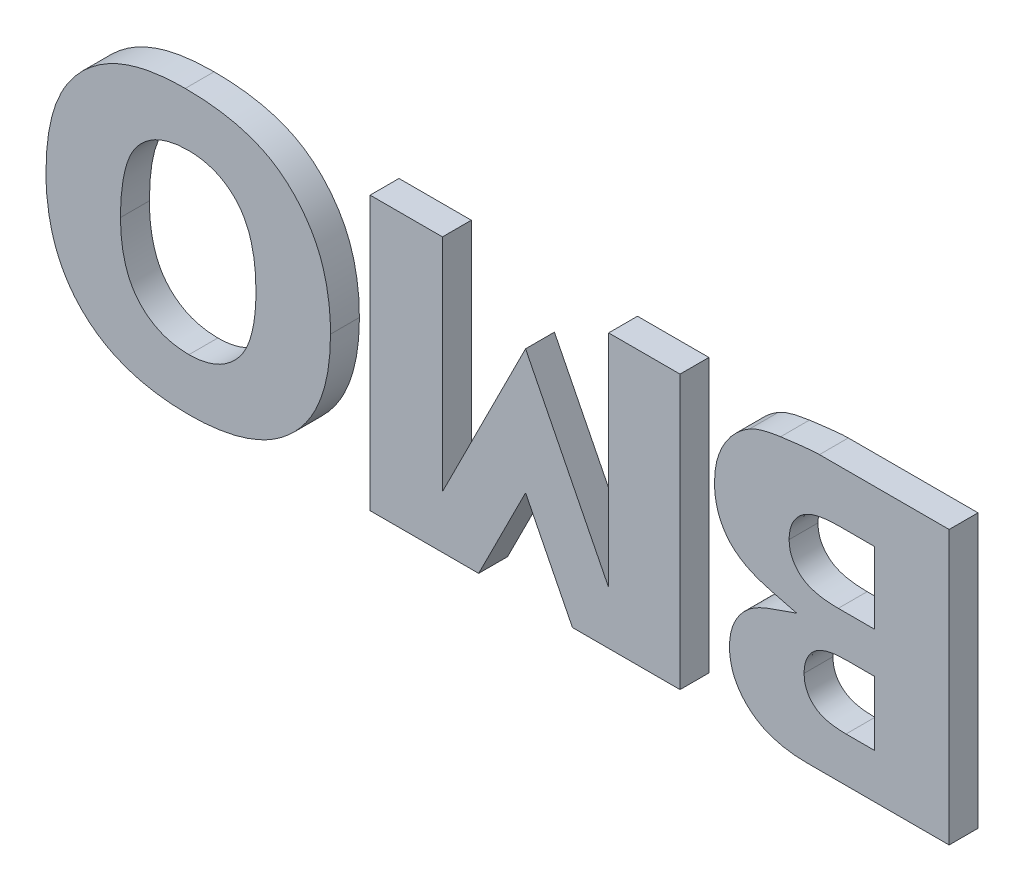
SolidWorks part; units mm, degrees
ref_plane "Front Plane" through (0, 0, 0) normal (0, 0, 1) x (1, 0, 0)
ref_plane "Top Plane" through (0, 0, 0) normal (0, 1, 0) x (1, 0, 0)
ref_plane "Right Plane" through (0, 0, 0) normal (1, 0, 0) x (0, 0, -1)
sketch "Sketch1" plane through (0, 0, 0) normal (0, 0, 1) x (1, 0, 0)
  line L19 (0.0088, 21.4902) -> (2.4024, 21.4902)
  line L20 (2.4024, 21.4902) -> (2.4024, 26.2173)
  line L21 (2.4024, 26.2173) -> (-0.0032, 26.2173)
  line L22 (0.0088, 21.4902) -> (2.4024, 21.4902)
  line L23 (2.4024, 21.4902) -> (2.4024, 26.2173)
  line L24 (2.4024, 26.2173) -> (-0.0032, 26.2173)
  line L25 (-10.4349, 29.6545) -> (-15.1464, 29.6545)
  line L26 (-10.4349, 11.6205) -> (-10.4349, 29.6545)
  line L27 (-17.5344, 11.6205) -> (-10.4349, 11.6205)
  line L28 (-20.6288, 17.7752) -> (-17.5344, 11.6205)
  line L29 (-23.7231, 11.6205) -> (-20.6288, 17.7752)
  line L30 (-30.8869, 11.6205) -> (-23.7231, 11.6205)
  line L31 (-30.8869, 29.6576) -> (-30.8869, 11.6205)
  line L32 (-26.1136, 29.6576) -> (-30.8869, 29.6576)
  line L33 (-26.1107, 15.1008) -> (-26.1136, 29.6576)
  line L34 (-20.6288, 26.0046) -> (-26.1107, 15.1008)
  line L35 (-15.1464, 15.0999) -> (-20.6288, 26.0046)
  line L36 (-15.1464, 29.6545) -> (-15.1464, 15.0999)
  line L37 (-10.4349, 29.6545) -> (-15.1464, 29.6545)
  line L38 (-10.4349, 11.6205) -> (-10.4349, 29.6545)
  line L39 (-17.5344, 11.6205) -> (-10.4349, 11.6205)
  line L40 (-20.6288, 17.7752) -> (-17.5344, 11.6205)
  line L41 (-23.7231, 11.6205) -> (-20.6288, 17.7752)
  line L42 (-30.8869, 11.6205) -> (-23.7231, 11.6205)
  line L43 (-30.8869, 29.6576) -> (-30.8869, 11.6205)
  line L44 (-26.1136, 29.6576) -> (-30.8869, 29.6576)
  line L45 (-26.1107, 15.1008) -> (-26.1136, 29.6576)
  line L46 (-20.6288, 26.0046) -> (-26.1107, 15.1008)
  line L47 (-15.1464, 15.0999) -> (-20.6288, 26.0046)
  line L48 (-15.1464, 29.6545) -> (-15.1464, 15.0999)
  line L52 (0.5196, 14.5629) -> (2.4024, 14.5629)
  line L53 (2.4024, 14.5629) -> (2.4024, 18.7952)
  line L54 (2.4024, 18.7952) -> (0.5565, 18.7952)
  line L55 (0.5196, 14.5629) -> (2.4024, 14.5629)
  line L56 (2.4024, 14.5629) -> (2.4024, 18.7952)
  line L57 (2.4024, 18.7952) -> (0.5565, 18.7952)
  line L62 (7.3241, 29.6545) -> (-1.2328, 29.6545)
  line L63 (7.3241, 11.6205) -> (7.3241, 29.6545)
  line L64 (-2.0181, 11.6205) -> (7.3241, 11.6205)
  line L65 (7.3241, 29.6545) -> (-1.2328, 29.6545)
  line L66 (7.3241, 11.6205) -> (7.3241, 29.6545)
  line L67 (-2.0181, 11.6205) -> (7.3241, 11.6205)
  spline S8 degree 3 poles (2946.2117, 319.9501) (-99.8182, -23.9874) (-36.9608, 2.5634) (-38.4871, 21.7907) (-38.5315, 22.1346) (-38.6293, 22.6467) (-38.6672, 22.8168) (-38.755, 23.1555) (-38.8052, 23.3239) (-38.9238, 23.6512) (-38.9925, 23.8107) (-39.145, 24.123) (-39.2289, 24.276) (-39.5162, 24.7183) (-39.7459, 24.9766) (-40.1351, 25.3211) (-40.2741, 25.4289) (-40.5653, 25.6223) (-40.7162, 25.7081) (-41.1836, 25.9357) (-41.5196, 26.0465) (-42.0303, 26.1518) (-42.2018, 26.1778) (-53.6648, 27.215) (-71.7276, -20.3538) (338.05, 3001.641) knots -6.698204 -6.698204 -6.698204 -6.698204 0.125 0.125 0.25 0.25 0.3125 0.3125 0.375 0.375 0.4375 0.4375 0.5 0.5 0.625 0.625 0.6875 0.6875 0.75 0.75 0.875 0.875 0.9375 0.9375 5.018063 5.018063 5.018063 5.018063 only from (-38.4226, 20.4017) to (-42.8967, 26.2174)
  spline S9 degree 3 poles (-568.1807, 2979.6168) (-11.22, -20.6149) (-31.9587, 27.2298) (-43.6103, 26.1769) (-43.7856, 26.1505) (-44.1331, 26.0814) (-44.3052, 26.0379) (-44.6448, 25.9272) (-44.814, 25.8594) (-45.3004, 25.6226) (-45.5957, 25.4204) (-46.1306, 24.9303) (-46.3603, 24.6553) (-46.632, 24.1881) (-46.7112, 24.0235) (-46.8504, 23.6914) (-46.9107, 23.5226) (-47.0709, 23.0095) (-47.1473, 22.6575) (-47.2602, 21.9439) (-47.2983, 21.5857) (-48.6988, 0.955) (11.489, -23.873) (-3042.5928, 181.7884) knots -3.982714 -3.982714 -3.982714 -3.982714 0.0625 0.0625 0.125 0.125 0.1875 0.1875 0.25 0.25 0.375 0.375 0.5 0.5 0.5625 0.5625 0.625 0.625 0.75 0.75 0.875 0.875 7.929813 7.929813 7.929813 7.929813 only from (-42.8967, 26.2174) to (-47.3555, 20.146)
  spline S10 degree 3 poles (-3012.2401, -435.0201) (16.0763, 66.7315) (-48.9102, 37.2156) (-47.2859, 18.8005) (-47.24, 18.4691) (-47.099, 17.8146) (-47.0072, 17.491) (-46.8197, 17.0142) (-46.7482, 16.8567) (-46.5883, 16.5556) (-46.4996, 16.4107) (-46.2052, 15.9939) (-45.9677, 15.7391) (-45.5763, 15.4116) (-45.4395, 15.3106) (-45.1516, 15.1271) (-44.9988, 15.0449) (-44.6872, 14.9018) (-44.5286, 14.8382) (-44.2044, 14.732) (-44.038, 14.6916) (-43.6996, 14.6268) (-43.5289, 14.6014) (-32.0948, 13.583) (-16.6311, 60.7758) (-270.0105, -2976.5611) knots -6.635897 -6.635897 -6.635897 -6.635897 0.125 0.125 0.25 0.25 0.375 0.375 0.4375 0.4375 0.5 0.5 0.625 0.625 0.6875 0.6875 0.75 0.75 0.8125 0.8125 0.875 0.875 0.9375 0.9375 5.049632 5.049632 5.049632 5.049632 only from (-47.3555, 20.146) to (-42.8422, 14.5628)
  spline S11 degree 3 poles (377.4254, -2955.6335) (-71.9445, 62.3905) (-53.3223, 13.5136) (-42.1506, 14.6053) (-41.9803, 14.6327) (-41.6424, 14.7056) (-41.474, 14.7521) (-41.1452, 14.8689) (-40.9863, 14.9376) (-40.6789, 15.0945) (-40.5303, 15.1827) (-40.2443, 15.3795) (-40.1066, 15.4892) (-39.7208, 15.8381) (-39.4951, 16.0996) (-39.1176, 16.6903) (-38.9718, 17.0049) (-38.739, 17.6604) (-38.6548, 18.0002) (-38.5292, 18.679) (-38.4854, 19.0208) (-36.9919, 38.2441) (-99.0006, 64.9771) (2944.805, -292.5563) knots -3.935499 -3.935499 -3.935499 -3.935499 0.0625 0.0625 0.125 0.125 0.1875 0.1875 0.25 0.25 0.3125 0.3125 0.375 0.375 0.5 0.5 0.625 0.625 0.75 0.75 0.875 0.875 7.737853 7.737853 7.737853 7.737853 only from (-42.8422, 14.5628) to (-38.4226, 20.4017)
  spline S12 degree 3 poles (-38.4226, 20.4017) (-38.4263, 20.7504) (-38.4322, 21.0989) (-38.4871, 21.7907) (-38.5315, 22.1346) (-38.6293, 22.6467) (-38.6672, 22.8168) (-38.755, 23.1555) (-38.8052, 23.3239) (-38.9238, 23.6512) (-38.9925, 23.8107) (-39.145, 24.123) (-39.2289, 24.276) (-39.5162, 24.7183) (-39.7459, 24.9766) (-40.1351, 25.3211) (-40.2741, 25.4289) (-40.5653, 25.6223) (-40.7162, 25.7081) (-41.1836, 25.9357) (-41.5196, 26.0465) (-42.0303, 26.1518) (-42.2018, 26.1778) (-42.5476, 26.2091) (-42.7221, 26.2133) (-42.8967, 26.2174) knots 0 0 0 0 0.125 0.125 0.25 0.25 0.3125 0.3125 0.375 0.375 0.4375 0.4375 0.5 0.5 0.625 0.625 0.6875 0.6875 0.75 0.75 0.875 0.875 0.9375 0.9375 1 1 1 1
  spline S13 degree 3 poles (-42.8967, 26.2174) (-43.0762, 26.2133) (-43.2557, 26.2089) (-43.6103, 26.1769) (-43.7856, 26.1505) (-44.1331, 26.0814) (-44.3052, 26.0379) (-44.6448, 25.9272) (-44.814, 25.8594) (-45.3004, 25.6226) (-45.5957, 25.4204) (-46.1306, 24.9303) (-46.3603, 24.6553) (-46.632, 24.1881) (-46.7112, 24.0235) (-46.8504, 23.6914) (-46.9107, 23.5226) (-47.0709, 23.0095) (-47.1473, 22.6575) (-47.2602, 21.9439) (-47.2983, 21.5857) (-47.347, 20.8673) (-47.3521, 20.5067) (-47.3555, 20.146) knots 0 0 0 0 0.0625 0.0625 0.125 0.125 0.1875 0.1875 0.25 0.25 0.375 0.375 0.5 0.5 0.5625 0.5625 0.625 0.625 0.75 0.75 0.875 0.875 1 1 1 1
  spline S14 degree 3 poles (-47.3555, 20.146) (-47.3516, 19.8073) (-47.3448, 19.4691) (-47.2859, 18.8005) (-47.24, 18.4691) (-47.099, 17.8146) (-47.0072, 17.491) (-46.8197, 17.0142) (-46.7482, 16.8567) (-46.5883, 16.5556) (-46.4996, 16.4107) (-46.2052, 15.9939) (-45.9677, 15.7391) (-45.5763, 15.4116) (-45.4395, 15.3106) (-45.1516, 15.1271) (-44.9988, 15.0449) (-44.6872, 14.9018) (-44.5286, 14.8382) (-44.2044, 14.732) (-44.038, 14.6916) (-43.6996, 14.6268) (-43.5289, 14.6014) (-43.1866, 14.5709) (-43.0144, 14.5668) (-42.8422, 14.5628) knots 0 0 0 0 0.125 0.125 0.25 0.25 0.375 0.375 0.4375 0.4375 0.5 0.5 0.625 0.625 0.6875 0.6875 0.75 0.75 0.8125 0.8125 0.875 0.875 0.9375 0.9375 1 1 1 1
  spline S15 degree 3 poles (-42.8422, 14.5628) (-42.6684, 14.5671) (-42.4945, 14.5717) (-42.1506, 14.6053) (-41.9803, 14.6327) (-41.6424, 14.7056) (-41.474, 14.7521) (-41.1452, 14.8689) (-40.9863, 14.9376) (-40.6789, 15.0945) (-40.5303, 15.1827) (-40.2443, 15.3795) (-40.1066, 15.4892) (-39.7208, 15.8381) (-39.4951, 16.0996) (-39.1176, 16.6903) (-38.9718, 17.0049) (-38.739, 17.6604) (-38.6548, 18.0002) (-38.5292, 18.679) (-38.4854, 19.0208) (-38.432, 19.7085) (-38.4263, 20.055) (-38.4226, 20.4017) knots 0 0 0 0 0.0625 0.0625 0.125 0.125 0.1875 0.1875 0.25 0.25 0.3125 0.3125 0.375 0.375 0.5 0.5 0.625 0.625 0.75 0.75 0.875 0.875 1 1 1 1
  spline S21 degree 3 poles (-426.6471, 3004.6541) (2.7345, -19.2274) (-24.4427, 30.7605) (-44.3381, 29.6086) (-44.6476, 29.5789) (-45.571, 29.4547) (-46.1804, 29.33) (-47.0783, 29.034) (-47.3725, 28.9191) (-47.9411, 28.6586) (-48.2169, 28.5127) (-48.7494, 28.1856) (-49.0061, 28.0027) (-49.5023, 27.6122) (-49.7345, 27.4027) (-50.1668, 26.9549) (-50.369, 26.7185) (-50.7444, 26.2197) (-50.9178, 25.9548) (-51.2328, 25.4109) (-51.3694, 25.1302) (-51.6125, 24.5562) (-51.7174, 24.2622) (-51.8941, 23.6602) (-51.9681, 23.3531) (-52.0887, 22.7385) (-52.1364, 22.4298) (-52.2108, 21.8101) (-52.2361, 21.4989) (-53.2951, 0.0038) (-7.4612, -26.4482) (-3039.4029, 293.0575) knots -3.869763 -3.869763 -3.869763 -3.869763 0.0625 0.0625 0.125 0.125 0.25 0.25 0.3125 0.3125 0.375 0.375 0.4375 0.4375 0.5 0.5 0.5625 0.5625 0.625 0.625 0.6875 0.6875 0.75 0.75 0.8125 0.8125 0.875 0.875 0.9375 0.9375 5.176446 5.176446 5.176446 5.176446 only from (-43.0891, 29.6545) to (-52.2771, 20.2473)
  spline S22 degree 3 poles (2936.5727, 439.8761) (-85.2498, -24.9192) (-32.3655, 2.5437) (-33.5481, 21.6686) (-33.5803, 21.9814) (-33.7114, 22.9143) (-33.846, 23.5287) (-34.1477, 24.4343) (-34.2653, 24.733) (-34.5358, 25.3053) (-34.6899, 25.5806) (-35.0241, 26.1161) (-35.2055, 26.3755) (-35.6041, 26.8737) (-35.8189, 27.1098) (-36.2688, 27.5534) (-36.5054, 27.7615) (-37.0069, 28.1444) (-37.2733, 28.318) (-38.1116, 28.7896) (-38.7013, 29.021) (-39.6192, 29.2787) (-39.9312, 29.3513) (-40.557, 29.4701) (-40.8712, 29.5166) (-41.5014, 29.5903) (-41.8177, 29.6162) (-62.9339, 30.6387) (-88.6306, -17.5161) (193.0725, 3019.9176) knots -3.671464 -3.671464 -3.671464 -3.671464 0.0625 0.0625 0.125 0.125 0.25 0.25 0.3125 0.3125 0.375 0.375 0.4375 0.4375 0.5 0.5 0.5625 0.5625 0.625 0.625 0.75 0.75 0.8125 0.8125 0.875 0.875 0.9375 0.9375 5.034664 5.034664 5.034664 5.034664 only from (-33.501, 20.4043) to (-43.0891, 29.6545)
  spline S23 degree 3 poles (351.3547, -2962.4639) (-89.1716, 57.6277) (-61.8367, 10.0625) (-41.6118, 11.1701) (-41.3033, 11.2009) (-40.3831, 11.3282) (-39.7758, 11.4537) (-38.8797, 11.7392) (-38.5844, 11.8504) (-38.0129, 12.1012) (-37.7346, 12.2405) (-37.1969, 12.5539) (-36.9381, 12.7292) (-36.4383, 13.1129) (-36.2, 13.3182) (-35.5317, 13.9716) (-35.1447, 14.4618) (-34.4883, 15.539) (-34.2348, 16.1089) (-33.9416, 17.0002) (-33.858, 17.3047) (-33.7195, 17.9167) (-33.6644, 18.2244) (-33.5796, 18.8428) (-33.5502, 19.1535) (-32.3597, 40.2905) (-78.0533, 66.5999) (2952.1693, -267.041) knots -3.944482 -3.944482 -3.944482 -3.944482 0.0625 0.0625 0.125 0.125 0.25 0.25 0.3125 0.3125 0.375 0.375 0.4375 0.4375 0.5 0.5 0.625 0.625 0.75 0.75 0.8125 0.8125 0.875 0.875 0.9375 0.9375 5.108022 5.108022 5.108022 5.108022 only from (-42.8579, 11.1258) to (-33.501, 20.4043)
  spline S24 degree 3 poles (-3023.8709, -388.5426) (-4.8731, 66.0069) (-53.367, 38.7648) (-52.231, 19.0054) (-52.1988, 18.6982) (-52.0666, 17.7822) (-51.9368, 17.178) (-51.6395, 16.288) (-51.5238, 15.9955) (-51.2618, 15.4316) (-51.1147, 15.1586) (-50.7877, 14.6307) (-50.6078, 14.3754) (-50.2112, 13.8875) (-49.9986, 13.6598) (-49.5497, 13.2317) (-49.3129, 13.0317) (-48.8124, 12.6626) (-48.5473, 12.4921) (-47.7283, 12.0321) (-47.1528, 11.7963) (-46.2552, 11.5253) (-45.9497, 11.4494) (-45.3384, 11.325) (-45.0312, 11.2753) (-44.4145, 11.1963) (-44.1048, 11.1682) (-22.9971, 10.0928) (3.2848, 55.8069) (-331.1674, -2974.4917) knots -3.865551 -3.865551 -3.865551 -3.865551 0.0625 0.0625 0.125 0.125 0.25 0.25 0.3125 0.3125 0.375 0.375 0.4375 0.4375 0.5 0.5 0.5625 0.5625 0.625 0.625 0.75 0.75 0.8125 0.8125 0.875 0.875 0.9375 0.9375 5.115347 5.115347 5.115347 5.115347 only from (-52.2771, 20.2473) to (-42.8579, 11.1258)
  spline S25 degree 3 poles (-43.0891, 29.6545) (-43.4023, 29.6497) (-43.7155, 29.6446) (-44.3381, 29.6086) (-44.6476, 29.5789) (-45.571, 29.4547) (-46.1804, 29.33) (-47.0783, 29.034) (-47.3725, 28.9191) (-47.9411, 28.6586) (-48.2169, 28.5127) (-48.7494, 28.1856) (-49.0061, 28.0027) (-49.5023, 27.6122) (-49.7345, 27.4027) (-50.1668, 26.9549) (-50.369, 26.7185) (-50.7444, 26.2197) (-50.9178, 25.9548) (-51.2328, 25.4109) (-51.3694, 25.1302) (-51.6125, 24.5562) (-51.7174, 24.2622) (-51.8941, 23.6602) (-51.9681, 23.3531) (-52.0887, 22.7385) (-52.1364, 22.4298) (-52.2108, 21.8101) (-52.2361, 21.4989) (-52.2668, 20.8742) (-52.272, 20.5608) (-52.2771, 20.2473) knots 0 0 0 0 0.0625 0.0625 0.125 0.125 0.25 0.25 0.3125 0.3125 0.375 0.375 0.4375 0.4375 0.5 0.5 0.5625 0.5625 0.625 0.625 0.6875 0.6875 0.75 0.75 0.8125 0.8125 0.875 0.875 0.9375 0.9375 1 1 1 1
  spline S26 degree 3 poles (-33.501, 20.4043) (-33.5048, 20.7217) (-33.5092, 21.0389) (-33.5481, 21.6686) (-33.5803, 21.9814) (-33.7114, 22.9143) (-33.846, 23.5287) (-34.1477, 24.4343) (-34.2653, 24.733) (-34.5358, 25.3053) (-34.6899, 25.5806) (-35.0241, 26.1161) (-35.2055, 26.3755) (-35.6041, 26.8737) (-35.8189, 27.1098) (-36.2688, 27.5534) (-36.5054, 27.7615) (-37.0069, 28.1444) (-37.2733, 28.318) (-38.1116, 28.7896) (-38.7013, 29.021) (-39.6192, 29.2787) (-39.9312, 29.3513) (-40.557, 29.4701) (-40.8712, 29.5166) (-41.5014, 29.5903) (-41.8177, 29.6162) (-42.4522, 29.6469) (-42.7706, 29.6508) (-43.0891, 29.6545) knots 0 0 0 0 0.0625 0.0625 0.125 0.125 0.25 0.25 0.3125 0.3125 0.375 0.375 0.4375 0.4375 0.5 0.5 0.5625 0.5625 0.625 0.625 0.75 0.75 0.8125 0.8125 0.875 0.875 0.9375 0.9375 1 1 1 1
  spline S27 degree 3 poles (-42.8579, 11.1258) (-42.5455, 11.1309) (-42.2331, 11.1361) (-41.6118, 11.1701) (-41.3033, 11.2009) (-40.3831, 11.3282) (-39.7758, 11.4537) (-38.8797, 11.7392) (-38.5844, 11.8504) (-38.0129, 12.1012) (-37.7346, 12.2405) (-37.1969, 12.5539) (-36.9381, 12.7292) (-36.4383, 13.1129) (-36.2, 13.3182) (-35.5317, 13.9716) (-35.1447, 14.4618) (-34.4883, 15.539) (-34.2348, 16.1089) (-33.9416, 17.0002) (-33.858, 17.3047) (-33.7195, 17.9167) (-33.6644, 18.2244) (-33.5796, 18.8428) (-33.5502, 19.1535) (-33.5151, 19.7777) (-33.508, 20.091) (-33.501, 20.4043) knots 0 0 0 0 0.0625 0.0625 0.125 0.125 0.25 0.25 0.3125 0.3125 0.375 0.375 0.4375 0.4375 0.5 0.5 0.625 0.625 0.75 0.75 0.8125 0.8125 0.875 0.875 0.9375 0.9375 1 1 1 1
  spline S28 degree 3 poles (-52.2771, 20.2473) (-52.2718, 19.9358) (-52.2666, 19.6244) (-52.231, 19.0054) (-52.1988, 18.6982) (-52.0666, 17.7822) (-51.9368, 17.178) (-51.6395, 16.288) (-51.5238, 15.9955) (-51.2618, 15.4316) (-51.1147, 15.1586) (-50.7877, 14.6307) (-50.6078, 14.3754) (-50.2112, 13.8875) (-49.9986, 13.6598) (-49.5497, 13.2317) (-49.3129, 13.0317) (-48.8124, 12.6626) (-48.5473, 12.4921) (-47.7283, 12.0321) (-47.1528, 11.7963) (-46.2552, 11.5253) (-45.9497, 11.4494) (-45.3384, 11.325) (-45.0312, 11.2753) (-44.4145, 11.1963) (-44.1048, 11.1682) (-43.4826, 11.1365) (-43.1703, 11.1311) (-42.8579, 11.1258) knots 0 0 0 0 0.0625 0.0625 0.125 0.125 0.25 0.25 0.3125 0.3125 0.375 0.375 0.4375 0.4375 0.5 0.5 0.5625 0.5625 0.625 0.625 0.75 0.75 0.8125 0.8125 0.875 0.875 0.9375 0.9375 1 1 1 1
  spline S29 degree 3 poles (-301.4301, 3010.7894) (31.0265, -20.5985) (12.4524, 27.1168) (-0.7679, 26.1849) (-0.9573, 26.1614) (-1.3333, 26.0904) (-1.5225, 26.0477) (-1.8846, 25.9245) (-2.0574, 25.8433) (-2.3838, 25.6366) (-2.5298, 25.5147) (-2.7874, 25.2335) (-2.8983, 25.0727) (-3.072, 24.7332) (-3.1385, 24.5499) (-5.0987, 15.4112) (61.6902, -3.6232) (-2975.0256, 432.7544) knots -8.422098 -8.422098 -8.422098 -8.422098 0.125 0.125 0.25 0.25 0.375 0.375 0.5 0.5 0.625 0.625 0.75 0.75 0.875 0.875 6.865074 6.865074 6.865074 6.865074 only from (-0.0032, 26.2173) to (-3.2378, 23.7938)
  spline S30 degree 3 poles (-2965.8554, -447.4581) (62.751, 52.3908) (-5.2102, 31.9322) (-3.1299, 23.0525) (-3.0592, 22.8733) (-2.8732, 22.5499) (-2.7573, 22.4) (-2.4916, 22.1318) (-2.3438, 22.0165) (-2.0161, 21.8266) (-1.8417, 21.7554) (-1.4848, 21.6431) (-1.3003, 21.6018) (-0.9287, 21.5411) (-0.742, 21.5209) (12.7501, 20.5987) (30.1928, 68.8585) (-212.215, -2970.69) knots -5.826836 -5.826836 -5.826836 -5.826836 0.125 0.125 0.25 0.25 0.375 0.375 0.5 0.5 0.625 0.625 0.75 0.75 0.875 0.875 9.755182 9.755182 9.755182 9.755182 only from (-3.2378, 23.7938) to (0.0088, 21.4902)
  spline S31 degree 3 poles (-0.0032, 26.2173) (-0.195, 26.2148) (-0.3867, 26.2118) (-0.7679, 26.1849) (-0.9573, 26.1614) (-1.3333, 26.0904) (-1.5225, 26.0477) (-1.8846, 25.9245) (-2.0574, 25.8433) (-2.3838, 25.6366) (-2.5298, 25.5147) (-2.7874, 25.2335) (-2.8983, 25.0727) (-3.072, 24.7332) (-3.1385, 24.5499) (-3.2186, 24.1763) (-3.2288, 23.9851) (-3.2378, 23.7938) knots 0 0 0 0 0.125 0.125 0.25 0.25 0.375 0.375 0.5 0.5 0.625 0.625 0.75 0.75 0.875 0.875 1 1 1 1
  spline S32 degree 3 poles (-3.2378, 23.7938) (-3.2274, 23.6057) (-3.2155, 23.4178) (-3.1299, 23.0525) (-3.0592, 22.8733) (-2.8732, 22.5499) (-2.7573, 22.4) (-2.4916, 22.1318) (-2.3438, 22.0165) (-2.0161, 21.8266) (-1.8417, 21.7554) (-1.4848, 21.6431) (-1.3003, 21.6018) (-0.9287, 21.5411) (-0.742, 21.5209) (-0.3675, 21.4953) (-0.1794, 21.4923) (0.0088, 21.4902) knots 0 0 0 0 0.125 0.125 0.25 0.25 0.375 0.375 0.5 0.5 0.625 0.625 0.75 0.75 0.875 0.875 1 1 1 1
  spline S35 degree 3 poles (-293.3116, 3004.1624) (37.1046, -63.9596) (14.1578, 21.2691) (-0.6142, 18.6903) (-0.7753, 18.6474) (-1.0903, 18.541) (-1.2436, 18.4744) (-1.5299, 18.29) (-1.6562, 18.1791) (-1.8778, 17.9234) (-1.9703, 17.78) (-2.1154, 17.4758) (-2.1694, 17.3129) (-3.8482, 8.677) (58.4662, -12.5454) (-2932.7562, 657.559) knots -10.748082 -10.748082 -10.748082 -10.748082 0.25 0.25 0.375 0.375 0.5 0.5 0.625 0.625 0.75 0.75 0.875 0.875 7.291731 7.291731 7.291731 7.291731 only from (0.5565, 18.7952) to (-2.248, 16.6435)
  spline S36 degree 3 poles (-2967.4813, -437.9377) (59.8185, 43.0408) (-3.9021, 24.31) (-2.1661, 15.9961) (-2.11, 15.8379) (-1.9611, 15.5462) (-1.8671, 15.4092) (-1.6465, 15.1647) (-1.5214, 15.0596) (-1.1021, 14.7953) (-0.7836, 14.6977) (13.198, 12.2032) (34.794, 92.3648) (-246.0996, -2975.0253) knots -6.254462 -6.254462 -6.254462 -6.254462 0.125 0.125 0.25 0.25 0.375 0.375 0.5 0.5 0.75 0.75 11.305392 11.305392 11.305392 11.305392 only from (-2.248, 16.6435) to (0.5196, 14.5629)
  spline S37 degree 3 poles (0.5565, 18.7952) (0.2201, 18.7899) (-0.1162, 18.7773) (-0.6142, 18.6903) (-0.7753, 18.6474) (-1.0903, 18.541) (-1.2436, 18.4744) (-1.5299, 18.29) (-1.6562, 18.1791) (-1.8778, 17.9234) (-1.9703, 17.78) (-2.1154, 17.4758) (-2.1694, 17.3129) (-2.2336, 16.9828) (-2.2414, 16.813) (-2.248, 16.6435) knots 0 0 0 0 0.25 0.25 0.375 0.375 0.5 0.5 0.625 0.625 0.75 0.75 0.875 0.875 1 1 1 1
  spline S38 degree 3 poles (-2.248, 16.6435) (-2.2411, 16.4794) (-2.2328, 16.3156) (-2.1661, 15.9961) (-2.11, 15.8379) (-1.9611, 15.5462) (-1.8671, 15.4092) (-1.6465, 15.1647) (-1.5214, 15.0596) (-1.1021, 14.7953) (-0.7836, 14.6977) (-0.1366, 14.5823) (0.1913, 14.5709) (0.5196, 14.5629) knots 0 0 0 0 0.125 0.125 0.25 0.25 0.375 0.375 0.5 0.5 0.75 0.75 1 1 1 1
  spline S51 degree 3 poles (-2971.2722, -445.6218) (38.7765, 42.9553) (-8.1512, 25.1344) (-7.1296, 15.1003) (-7.1033, 14.9486) (-7.0353, 14.6475) (-6.9931, 14.4981) (-6.8877, 14.2037) (-6.8244, 14.0629) (-6.6063, 13.6573) (-6.4337, 13.4032) (-6.022, 12.9351) (-5.7928, 12.7288) (-5.4166, 12.4579) (-5.2847, 12.3738) (-5.0143, 12.2225) (-4.8756, 12.155) (-4.4506, 11.9743) (-4.154, 11.8811) (-3.5515, 11.7391) (-3.2476, 11.6917) (13.0973, 10.0757) (36.7488, 74.3123) (-299.4883, -2973.2854) knots -3.958897 -3.958897 -3.958897 -3.958897 0.0625 0.0625 0.125 0.125 0.1875 0.1875 0.25 0.25 0.375 0.375 0.5 0.5 0.5625 0.5625 0.625 0.625 0.75 0.75 0.875 0.875 7.428415 7.428415 7.428415 7.428415 only from (-7.1691, 15.7184) to (-2.0181, 11.6205)
  spline S52 degree 3 poles (-2389.1673, 1840.4789) (35.8966, 9.0629) (-0.7627, 25.1154) (-6.5139, 17.8312) (-6.5787, 17.739) (-6.76, 17.4526) (-6.8594, 17.2498) (-7.0179, 16.8323) (-7.0772, 16.6148) (-7.1348, 16.2808) (-7.1491, 16.169) (-7.7964, 6.915) (29.5028, -5.6993) (-2996.839, 262.1084) knots -10.047812 -10.047812 -10.047812 -10.047812 0.125 0.125 0.25 0.25 0.5 0.5 0.75 0.75 0.875 0.875 11.043013 11.043013 11.043013 11.043013 only from (-6.2252, 18.1778) to (-7.1691, 15.7184)
  spline S53 degree 3 poles (2826.7046, 1016.9441) (1883.2516, 684.4684) (939.7985, 351.9923) (-3.9625, 19.4077) (-4.2714, 19.3018) (-4.7313, 19.1336) (-4.8834, 19.074) (-5.1792, 18.9375) (-5.324, 18.8613) (-5.6051, 18.6969) (-5.7413, 18.609) (-13.0631, 12.73) (12.8663, -36.383) (-1847.1594, 2381.7487) knots -765.764298 -765.764298 -765.764298 -765.764298 0.25 0.25 0.5 0.5 0.625 0.625 0.75 0.75 0.875 0.875 8.011774 8.011774 8.011774 8.011774 only from (-2.7309, 19.8417) to (-6.2252, 18.1778)
  spline S54 degree 3 poles (-2976.1755, -408.1974) (36.2479, 54.1203) (-9.049, 35.4763) (-8.1254, 23.9346) (-8.1033, 23.7703) (-8.0406, 23.4446) (-8.0005, 23.2831) (-7.9017, 22.963) (-7.8428, 22.8046) (-7.7042, 22.5016) (-7.6262, 22.3549) (-7.4515, 22.0716) (-7.3505, 21.9364) (-7.1343, 21.6789) (-7.0192, 21.5578) (-6.7703, 21.3369) (-6.6379, 21.2354) (-6.3616, 21.0451) (-6.2181, 20.9563) (-5.9242, 20.7998) (-5.7734, 20.7304) (-5.4691, 20.5983) (-5.3147, 20.5375) (-4.9997, 20.4304) (-4.8394, 20.3834) (-4.3542, 20.253) (-4.029, 20.173) (965.5692, -227.245) (1934.8428, -474.5801) (2904.1166, -721.9161) knots -4.227998 -4.227998 -4.227998 -4.227998 0.0625 0.0625 0.125 0.125 0.1875 0.1875 0.25 0.25 0.3125 0.3125 0.375 0.375 0.4375 0.4375 0.5 0.5 0.5625 0.5625 0.625 0.625 0.6875 0.6875 0.75 0.75 0.875 0.875 374.222374 374.222374 374.222374 374.222374 only from (-8.1587, 24.6006) to (-2.7309, 19.8417)
  spline S55 degree 3 poles (-1943.1023, 2319.1004) (49.4535, -0.5502) (2.8521, 35.5485) (-6.5316, 28.3327) (-6.6853, 28.1916) (-6.9752, 27.889) (-7.1122, 27.7259) (-7.36, 27.3849) (-7.4712, 27.2076) (-7.6711, 26.8408) (-7.7595, 26.6512) (-7.9105, 26.258) (-7.9731, 26.0542) (-8.0704, 25.6455) (-8.1055, 25.4391) (-9.3536, 12.4242) (40.0649, -7.9624) (-2980.2524, 431.1073) knots -6.83174 -6.83174 -6.83174 -6.83174 0.125 0.125 0.25 0.25 0.375 0.375 0.5 0.5 0.625 0.625 0.75 0.75 0.875 0.875 8.548106 8.548106 8.548106 8.548106 only from (-5.8449, 28.8142) to (-8.1587, 24.6006)
  spline S56 degree 3 poles (-447.1181, 2996.2222) (30.6586, -2.5258) (10.1225, 31.9132) (-4.5035, 29.2769) (-4.6778, 29.2386) (-5.0231, 29.1493) (-5.1954, 29.1007) (-14.4219, 25.7092) (0.9021, -36.5035) (-1179.7711, 2789.3947) knots -20.32009 -20.32009 -20.32009 -20.32009 0.25 0.25 0.5 0.5 0.75 0.75 14.33931 14.33931 14.33931 14.33931 only from (-3.7992, 29.3926) to (-5.8449, 28.8142)
  spline S57 degree 3 poles (-154.5226, 3025.3496) (21.0168, -6.5743) (8.584, 30.2554) (-1.6627, 29.6375) (-1.7697, 29.6267) (-1.984, 29.6075) (-2.0912, 29.599) (-2.3052, 29.5777) (-2.412, 29.5652) (-48.7568, 24.1405) (-89.0441, -30.2081) (-482.9491, 2988.9325) knots -11.685016 -11.685016 -11.685016 -11.685016 0.125 0.125 0.25 0.25 0.375 0.375 0.5 0.5 54.615615 54.615615 54.615615 54.615615 only from (-1.2328, 29.6545) to (-3.7992, 29.3926)
  spline S58 degree 3 poles (-7.1691, 15.7184) (-7.1649, 15.5629) (-7.1609, 15.4075) (-7.1296, 15.1003) (-7.1033, 14.9486) (-7.0353, 14.6475) (-6.9931, 14.4981) (-6.8877, 14.2037) (-6.8244, 14.0629) (-6.6063, 13.6573) (-6.4337, 13.4032) (-6.022, 12.9351) (-5.7928, 12.7288) (-5.4166, 12.4579) (-5.2847, 12.3738) (-5.0143, 12.2225) (-4.8756, 12.155) (-4.4506, 11.9743) (-4.154, 11.8811) (-3.5515, 11.7391) (-3.2476, 11.6917) (-2.6357, 11.6312) (-2.327, 11.6249) (-2.0181, 11.6205) knots 0 0 0 0 0.0625 0.0625 0.125 0.125 0.1875 0.1875 0.25 0.25 0.375 0.375 0.5 0.5 0.5625 0.5625 0.625 0.625 0.75 0.75 0.875 0.875 1 1 1 1
  spline S59 degree 3 poles (-6.2252, 18.1778) (-6.2998, 18.093) (-6.3743, 18.0081) (-6.5139, 17.8312) (-6.5787, 17.739) (-6.76, 17.4526) (-6.8594, 17.2498) (-7.0179, 16.8323) (-7.0772, 16.6148) (-7.1348, 16.2808) (-7.1491, 16.169) (-7.1648, 15.9442) (-7.1669, 15.8313) (-7.1691, 15.7184) knots 0 0 0 0 0.125 0.125 0.25 0.25 0.5 0.5 0.75 0.75 0.875 0.875 1 1 1 1
  spline S60 degree 3 poles (-2.7309, 19.8417) (-3.0388, 19.7332) (-3.3467, 19.6247) (-3.9625, 19.4077) (-4.2714, 19.3018) (-4.7313, 19.1336) (-4.8834, 19.074) (-5.1792, 18.9375) (-5.324, 18.8613) (-5.6051, 18.6969) (-5.7413, 18.609) (-5.9934, 18.4066) (-6.1092, 18.2921) (-6.2252, 18.1778) knots 0 0 0 0 0.25 0.25 0.5 0.5 0.625 0.625 0.75 0.75 0.875 0.875 1 1 1 1
  spline S61 degree 3 poles (-8.1587, 24.6006) (-8.1554, 24.4333) (-8.152, 24.2661) (-8.1254, 23.9346) (-8.1033, 23.7703) (-8.0406, 23.4446) (-8.0005, 23.2831) (-7.9017, 22.963) (-7.8428, 22.8046) (-7.7042, 22.5016) (-7.6262, 22.3549) (-7.4515, 22.0716) (-7.3505, 21.9364) (-7.1343, 21.6789) (-7.0192, 21.5578) (-6.7703, 21.3369) (-6.6379, 21.2354) (-6.3616, 21.0451) (-6.2181, 20.9563) (-5.9242, 20.7998) (-5.7734, 20.7304) (-5.4691, 20.5983) (-5.3147, 20.5375) (-4.9997, 20.4304) (-4.8394, 20.3834) (-4.3542, 20.253) (-4.029, 20.173) (-3.3799, 20.0074) (-3.0554, 19.9245) (-2.7309, 19.8417) knots 0 0 0 0 0.0625 0.0625 0.125 0.125 0.1875 0.1875 0.25 0.25 0.3125 0.3125 0.375 0.375 0.4375 0.4375 0.5 0.5 0.5625 0.5625 0.625 0.625 0.6875 0.6875 0.75 0.75 0.875 0.875 1 1 1 1
  spline S62 degree 3 poles (-5.8449, 28.8142) (-6.0226, 28.7008) (-6.2003, 28.5874) (-6.5316, 28.3327) (-6.6853, 28.1916) (-6.9752, 27.889) (-7.1122, 27.7259) (-7.36, 27.3849) (-7.4712, 27.2076) (-7.6711, 26.8408) (-7.7595, 26.6512) (-7.9105, 26.258) (-7.9731, 26.0542) (-8.0704, 25.6455) (-8.1055, 25.4391) (-8.1455, 25.0219) (-8.1521, 24.8112) (-8.1587, 24.6006) knots 0 0 0 0 0.125 0.125 0.25 0.25 0.375 0.375 0.5 0.5 0.625 0.625 0.75 0.75 0.875 0.875 1 1 1 1
  spline S63 degree 3 poles (-3.7992, 29.3926) (-3.9757, 29.3664) (-4.1522, 29.3402) (-4.5035, 29.2769) (-4.6778, 29.2386) (-5.0231, 29.1493) (-5.1954, 29.1007) (-5.5287, 28.9782) (-5.6872, 28.897) (-5.8449, 28.8142) knots 0 0 0 0 0.25 0.25 0.5 0.5 0.75 0.75 1 1 1 1
  spline S64 degree 3 poles (-1.2328, 29.6545) (-1.3405, 29.6527) (-1.448, 29.6505) (-1.6627, 29.6375) (-1.7697, 29.6267) (-1.984, 29.6075) (-2.0912, 29.599) (-2.3052, 29.5777) (-2.412, 29.5652) (-2.946, 29.5027) (-3.3727, 29.4485) (-3.7992, 29.3926) knots 0 0 0 0 0.125 0.125 0.25 0.25 0.375 0.375 0.5 0.5 1 1 1 1
  dimension "D1" = 0.508
  dimension "D2" = 0.508
  dimension "D3" = 0.508
  dimension "D4" = 0.508
  dimension "D5" = 0.508
  dimension "D6" = 0.508
extrude "Boss-Extrude1" add sketch "Sketch1" along normal blind 1.905
